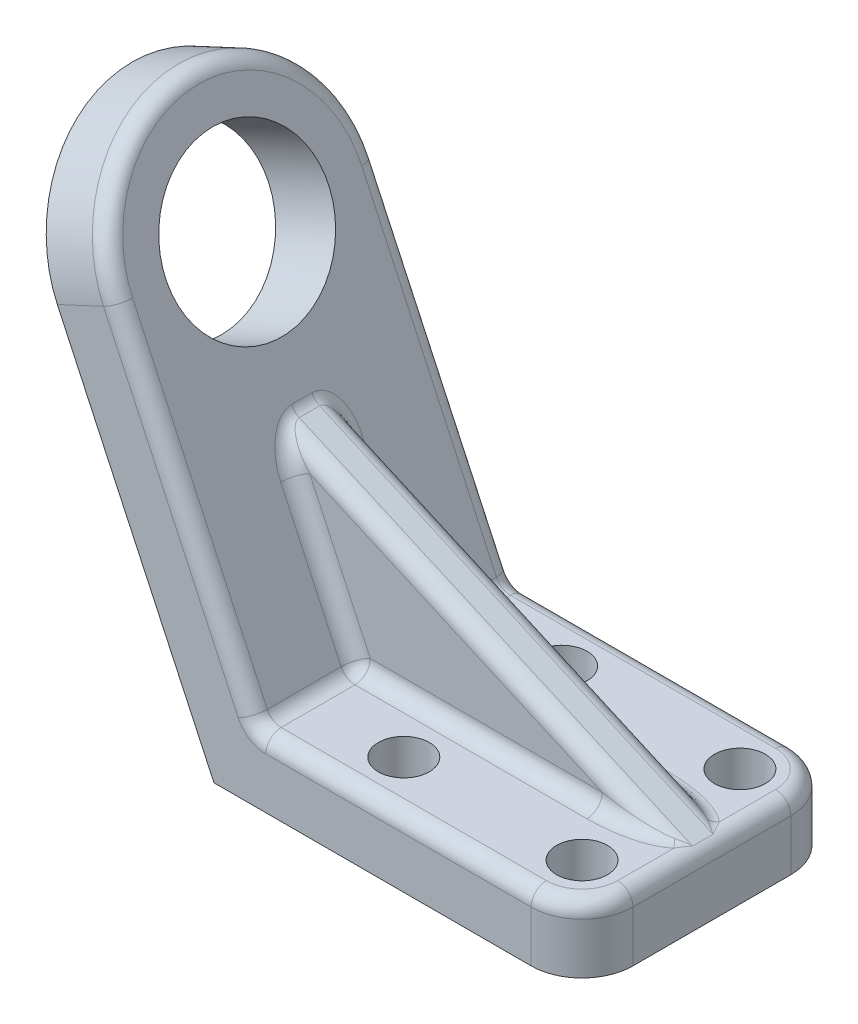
SolidWorks part; units mm, degrees
ref_plane "Front" through (0, 0, 0) normal (0, 0, 1) x (1, 0, 0)
ref_plane "Top" through (0, 0, 0) normal (0, 1, 0) x (1, 0, 0)
ref_plane "Right" through (0, 0, 0) normal (1, 0, 0) x (0, 0, -1)
sketch "Sketch1" plane through (0, 0, 0) normal (0, 0, 1) x (1, 0, 0)
  line L0 (0, 0) -> (128, 0)
  line L1 (0, 0) -> (-76.0713, 163.1354)
  dimension "D1" = 65
  dimension "D2" = 128
  dimension "D3" = 180
extrude "Base-Extrude-Thin" add sketch "Sketch1" along normal mid plane 102 thin
sketch "Sketch7" plane through (0, 0, 0) normal (0, 0, 1) x (1, 0, 0)
  line L1 (-76.0713, 163.1354) -> (0, 0)
  line L5 (128, 0) -> (128, -26)
  line L7 (-16.5638, -26) -> (128, -26)
  line L9 (-99.6353, 152.1473) -> (-16.5638, -26)
  line L13 (-76.0713, 163.1354) -> (-99.6353, 152.1473)
  line L18 (0, 0) -> (128, 0)
  point P0 (287.121, 231.9208)
sketch "Sketch4" plane through (0, 0, 0) normal (0.9063, 0.4226, 0) x (0, 0, -1)
  line L0 (-51, 0) -> (-51, 180) construction
  line L1 (51, 0) -> (51, 180) construction
  line L3 (-51, 129) -> (51, 129) construction
  line L4 (-51, 180) -> (51, 180) construction
  arc A0 (-51, 129) -> (51, 129) centre (0, 129) cw
extrude "Cut-Extrude1" cut sketch "Sketch4" against normal through all
sketch "Sketch5" plane through (0, 0, 0) normal (0.9063, 0.4226, 0) x (0, 0, -1)
  circle A0 centre (0, 129) radius 32
  dimension "D1" = 64
extrude "Cut-Extrude2" cut sketch "Sketch5" against normal through all
fillet "Fillet4" radius 20 2 edges at (128, -13, 51) (128, -13, -51)
fillet "Fillet7" radius 6 1 edges at (0, 0, 0)
sketch "Sketch6" plane through (0, 0, 0) normal (0, 1, 0) x (-1, 0, 0)
  circle A0 centre (-108, 31) radius 10
  circle A1 centre (-108, -31) radius 10
  arc A2 (-128, -31) -> (-108, -51) centre (-108, -31) ccw construction
  arc A3 (-108, 51) -> (-128, 31) centre (-108, 31) ccw construction
  dimension "D1" = 20
extrude "Cut-Extrude3" cut sketch "Sketch6" against normal through all
pattern_linear "LPattern1" count 2 spacing 70 along (-1, 0, 0) of "Cut-Extrude3"
fillet "Fillet3" radius 6 10 edges at (-76.0713, 163.1354, 0) (128, 0, 0) (55.9112, 0, 51) (55.9112, 0, -51) (122.1421, 0, -45.1421) (122.1421, 0, 45.1421) (-28.0666, 60.189, 51) (-28.0666, 60.189, -51) (0.5986, 0.9397, -51) (0.5986, 0.9397, 51)
sketch "Sketch2" plane through (0, 0, 0) normal (0, 0, 1) x (1, 0, 0)
  line L0 (124.4315, -0.5147) -> (-32.119, 68.8794)
  line L2 (-54.5178, 116.9137) -> (-1.6154, 3.4643) construction
  arc A0 (128, -6) -> (122, 0) centre (122, -6) ccw construction
  dimension "D1" = 76
rib "Rib2" sketch "Sketch2" sketch "Sketch2" thickness 20 extrusion direction parallel to sketch draft on no parameters "D1"=20
fillet "Fillet5" radius 6 4 edges at (123.2427, -0.1301, 10) (46.1562, 34.1823, -10) (46.1562, 34.1823, 10) (123.2427, -0.1301, -10)
fillet "Fillet6" radius 6 13 edges at (0.5986, 0.9397, -10) (-14.9383, 32.0353, -10) (0.5986, 0.9397, 10) (-14.9383, 32.0353, 10) (-32.119, 68.8794, 0) (56.1433, 0, -10) (56.1433, 0, 10) (-30.9891, 66.4563, -8.2426) (116.5383, 0, -9.0293) (123.2427, -0.1301, -5.2427) (-30.9891, 66.4563, 8.2426) (123.2427, -0.1301, 5.2427) (116.5383, 0, 9.0293)
